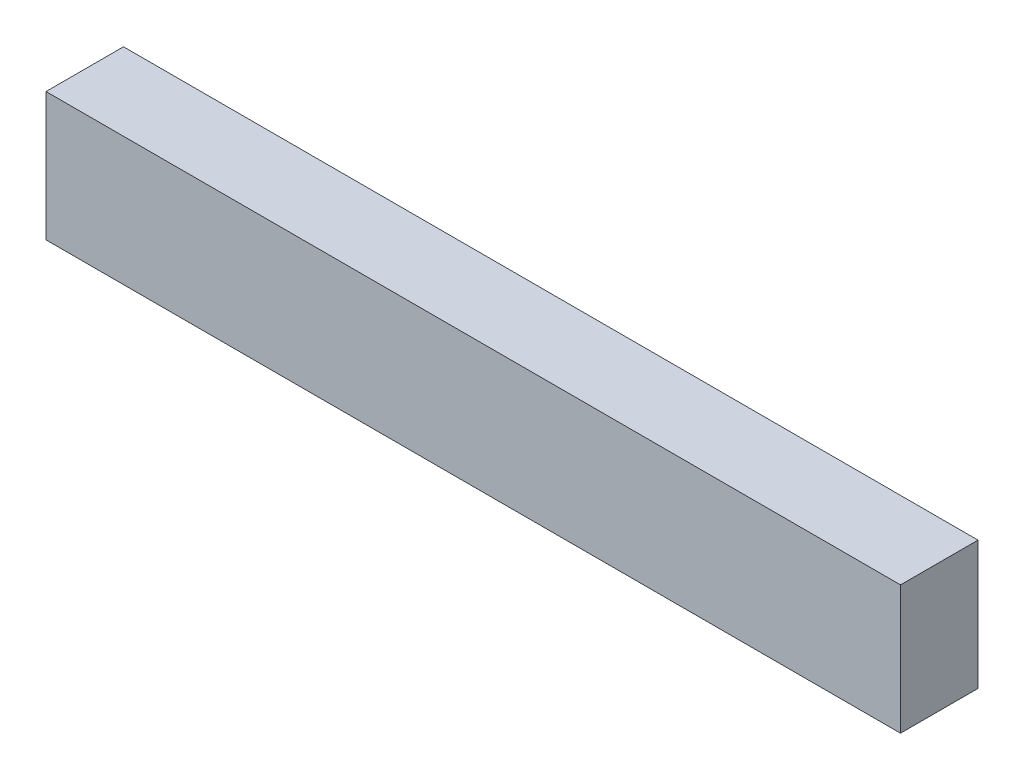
SolidWorks part; units mm, degrees
ref_plane "Front Plane" through (0, 0, 0) normal (0, 0, 1) x (1, 0, 0)
ref_plane "Top Plane" through (0, 0, 0) normal (0, 1, 0) x (1, 0, 0)
ref_plane "Right Plane" through (0, 0, 0) normal (1, 0, 0) x (0, 0, -1)
sketch "Sketch1" plane through (0, 0, 0) normal (0, 0, 1) x (1, 0, 0)
  line L1 (0, 0) -> (419, 0)
  line L2 (0, 0) -> (0, 63)
  line L3 (0, 63) -> (419, 63)
  line L4 (419, 0) -> (419, 63)
  dimension "D1" = 419
  dimension "D2" = 63
extrude "Boss-Extrude1" add sketch "Sketch1" along normal blind 38
